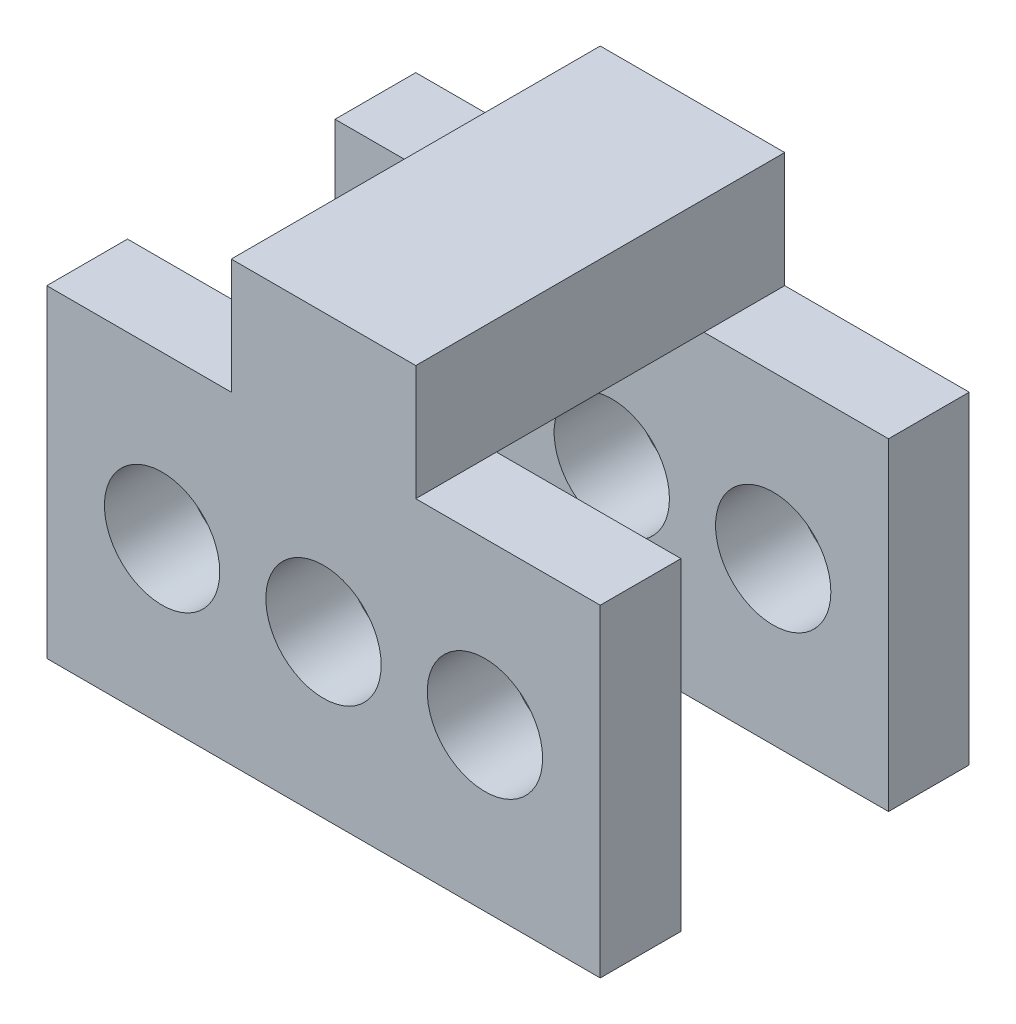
SolidWorks part; units mm, degrees
ref_plane "前视基准面" through (0, 0, 0) normal (0, 0, 1) x (1, 0, 0)
ref_plane "上视基准面" through (0, 0, 0) normal (0, 1, 0) x (1, 0, 0)
ref_plane "右视基准面" through (0, 0, 0) normal (1, 0, 0) x (0, 0, -1)
sketch "草图2" plane through (0, 0, 0) normal (0, 0, 1) x (1, 0, 0)
  line L0 (0, 0) -> (0, 60.2359) construction
  line L1 (-16, 28) -> (16, 28)
  line L5 (1.7048, 0) -> (70.7488, 0) construction
  line L6 (16, 28) -> (16, 48)
  line L7 (16, 48) -> (-16, 48)
  line L8 (-16, 48) -> (-16, 28)
extrude "拉伸1" add sketch "草图2" along normal mid plane 64
sketch "草图3" plane through (0, 0, 32) normal (0, 0, 1) x (1, 0, 0)
  line L0 (0, 0) -> (0, -36.4589) construction
  line L1 (-48, 28) -> (48, 28)
  line L2 (-48, 28) -> (-48, -28)
  line L3 (-48, -28) -> (48, -28)
  line L4 (48, 28) -> (48, -28)
  line L5 (0, -36.4589) -> (0, 0) construction
  line L6 (0, 0) -> (-71.265, 0) construction
  line L7 (-16, 28) -> (16, 28) construction
  circle A0 centre (0, 0) radius 10
  circle A1 centre (-28, 0) radius 10
  circle A2 centre (28, 0) radius 10
extrude "拉伸2" add sketch "草图3" against normal blind 14
mirror "镜向1" about plane through (0, 0, 0) normal (0, 0, 1) of "拉伸2"
